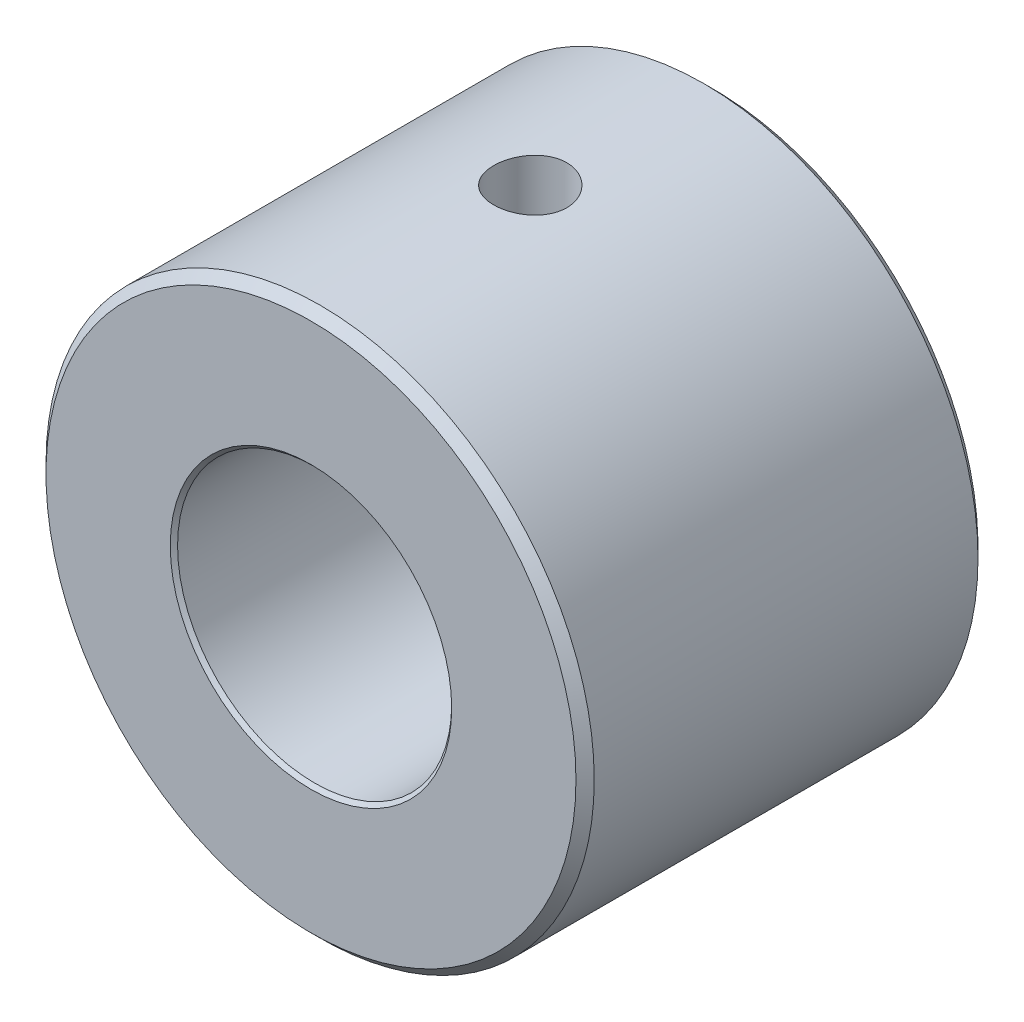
SolidWorks part; units mm, degrees
ref_plane "Front" through (0, 0, 0) normal (0, 0, 1) x (1, 0, 0)
ref_plane "Top" through (0, 0, 0) normal (0, 1, 0) x (1, 0, 0)
ref_plane "Right" through (0, 0, 0) normal (1, 0, 0) x (0, 0, -1)
sketch "Esquisse1" plane through (0, 0, 0) normal (1, 0, 0) x (0, 0, -1)
  line L0 (0, 0) -> (-10, 0) construction
  line L1 (-10, 7.5) -> (-10, 15)
  line L2 (-10, 15) -> (12, 15)
  line L4 (0, 0) -> (-10, 0) construction
  line L5 (-10, 7.5) -> (12, 7.5)
  line L6 (12, 7.5) -> (12, 15)
  line L7 (0, 50) -> (0, -50) construction
  dimension "D1" = 15
  dimension "D2" = 22
  dimension "D3" = 30
  dimension "D4" = 10
revolve "Révolution1" add sketch "Esquisse1" angle 360 about L0
chamfer "Chanfrein1" distance 0.2 angle 45 2 edges at (-7.5, 0, -12) (-7.5, 0, 10)
chamfer "Chanfrein2" distance 0.5 angle 45 2 edges at (-15, 0, -12) (-15, 0, 10)
sketch "Esquisse2" plane through (0, 0, -12) normal (0, 0, 1) x (1, 0, 0)
  line L0 (-15, 0) -> (15, 0) construction
  line L10 (-17.3129, -12) -> (18.2299, -12)
  line L11 (-17.3129, -12) -> (-17.3129, -22.3485)
  line L12 (-17.3129, -22.3485) -> (18.2299, -22.3485)
  line L13 (18.2299, -12) -> (18.2299, -22.3485)
  circle A1 centre (0, 0) radius 15 construction
  dimension "D1" = 12
extrude "Enlèv. mat.-Extru.1" cut sketch "Esquisse2" along normal blind 20.1
hole_wizard "Trou taraudé M41" positions "Esquisse5" profile "Esquisse6" tap size "M4" standard "ISO"
sketch "Esquisse5" plane through (0, -12, 0) normal (0, -1, 0) x (-1, 0, 0)
  line L2 (-8.1394, 12) -> (8.1394, 12) construction
  point P0 (0, 2)
  dimension "D1" = 10
sketch "Esquisse6" plane through (0, -12, -2) normal (1, 0, 0) x (0, 0, -1)
  line L0 (0, 0) -> (0, 4.5)
  line L1 (0, 4.5) -> (1.65, 4.5)
  line L2 (1.65, 4.5) -> (1.65, 0)
  line L5 (1.65, 0) -> (0, 0)
  line L11 (0, -6.35) -> (0, 107.95) construction
  dimension "Diamètre du trou pour taraudage jusqu'au prochain" = 3.3
  dimension "Profondeur du trou pour taraudage jusqu'au prochain" = 4.5
ref_plane "Plan1" through (0, 15, 0) normal (0, 1, 0) x (1, 0, 0)
hole_wizard "Trou taraudé M62" positions "Esquisse8" profile "Esquisse9" tap size "M6" standard "ISO"
sketch "Esquisse8" plane through (0, 15, 0) normal (0, 1, 0) x (1, 0, 0)
  line L1 (14.5, 12) -> (-14.5, 12) construction
  point P0 (0, 2)
  dimension "D1" = 10
sketch "Esquisse9" plane through (0, 15, -2) normal (1, 0, 0) x (0, 0, 1)
  line L0 (0, 0) -> (0, 7.5)
  line L1 (0, 7.5) -> (2, 7.5)
  line L2 (2, 7.5) -> (2, 0)
  line L5 (2, 0) -> (0, 0)
  line L11 (0, -6.35) -> (0, 107.95) construction
  dimension "Diamètre du trou pour taraudage jusqu'au prochain" = 4
  dimension "Profondeur du trou pour taraudage jusqu'au prochain" = 7.5
